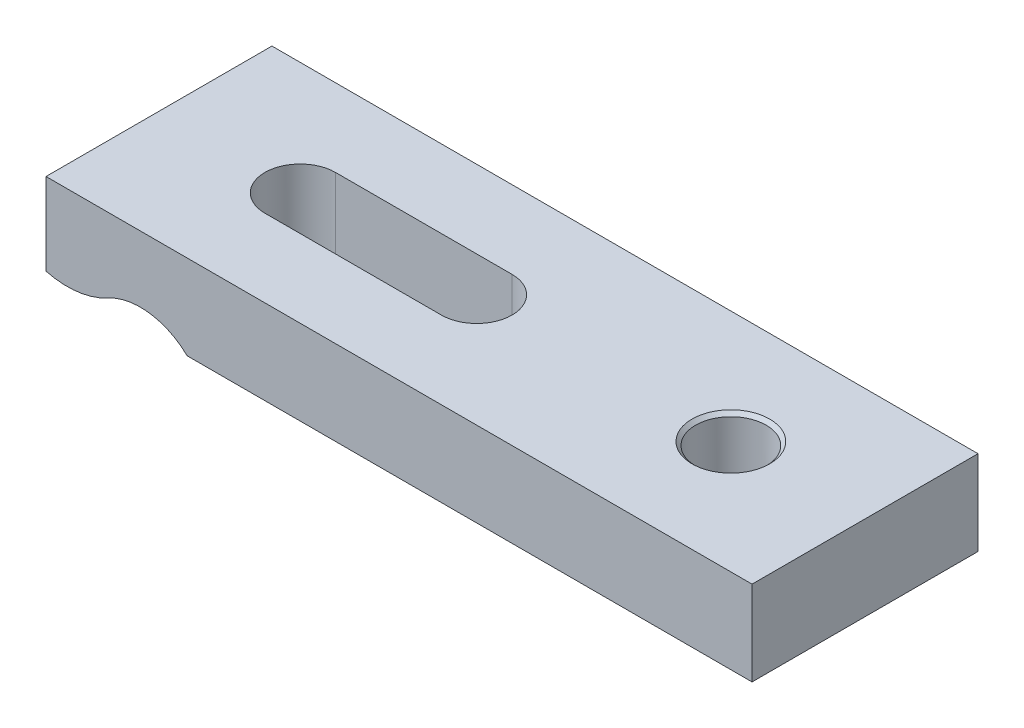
SolidWorks part; units mm, degrees
ref_plane "Plan1" through (0, 0, 0) normal (0, 0, 1) x (1, 0, 0)
ref_plane "Plan2" through (0, 0, 0) normal (0, 1, 0) x (1, 0, 0)
ref_plane "Plan3" through (0, 0, 0) normal (1, 0, 0) x (0, 0, -1)
sketch "Esquisse1" plane through (0, 0, 0) normal (0, 0, 1) x (1, 0, 0)
  line L0 (0, 0) -> (100, 0)
  line L1 (100, 0) -> (100, -12)
  line L2 (19.9964, -12) -> (100, -12)
  line L5 (0, 0) -> (0, -11.619)
  arc A0 (8.7617, -10.5263) -> (19.9964, -12) centre (13.3711, -18.9473) cw
  arc A1 (0, -11.619) -> (8.7617, -10.5263) centre (3, 0) ccw
  dimension "D2" = 100
  dimension "E" = 12
  dimension "D5" = 9.6
  dimension "D1" = 20
  dimension "D4" = 3
extrude "Base-Extrusion" add sketch "Esquisse1" along normal blind 32
sketch "Esquisse2" plane through (0, 0, 0) normal (0, 1, 0) x (1, 0, 0)
  line L0 (-9.5, -16) -> (57, -16) construction
  line L1 (100, 0) -> (0, 0) construction
  line L2 (20, 3.5) -> (20, -20) construction
  line L3 (45, 3.5) -> (45, -20) construction
  line L4 (20, -11) -> (45, -11)
  line L5 (20, -21) -> (45, -21)
  arc A0 (20, -11) -> (20, -21) centre (20, -16) ccw
  arc A1 (45, -21) -> (45, -11) centre (45, -16) ccw
  dimension "D1" = 16
  dimension "D3" = 10
  dimension "D4" = 45
  dimension "D5" = 25
extrude "Enlèv. mat.-Extru.1" cut sketch "Esquisse2" against normal through all
ref_plane "Plan4" through (0, 10, 0) normal (0, 1, 0) x (-1, 0, 0)
ref_plane "Plan5" through (100, 0, 0) normal (1, 0, 0) x (0, 0, -1)
sketch "Esquisse3" plane through (0, 0, 0) normal (0, 1, 0) x (1, 0, 0)
  line L2 (11, -16) -> (41, -16) construction
  circle A0 centre (81, -16) radius 5
  arc A2 (45, -21) -> (45, -11) centre (45, -16) ccw construction
  dimension "D1" = 36
  dimension "D2" = 10
extrude "Enlèv. mat.-Extru.2" cut sketch "Esquisse3" against normal blind 12
chamfer "Chanfrein3" distance 0.5 angle 45 2 edges at (81, -12, 21) (81, 0, 21)
equation "\"D5@Esquisse1\" = \"E@Esquisse1\"*.8"
equation "\"D1@Esquisse2\"=\"D1@Base-Extrusion\"/2"
